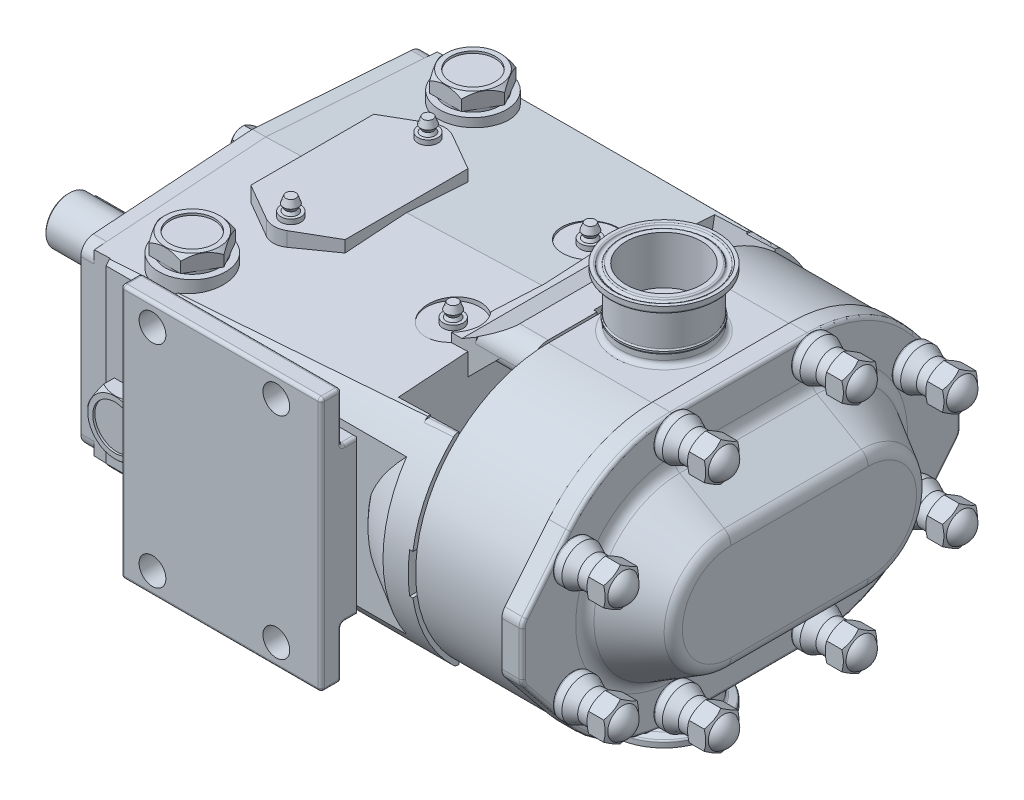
SolidWorks part; units mm, degrees
ref_plane "Front Plane" through (0, 0, 0) normal (0, 0, 1) x (1, 0, 0)
ref_plane "Top Plane" through (0, 0, 0) normal (0, 1, 0) x (1, 0, 0)
ref_plane "Right Plane" through (0, 0, 0) normal (1, 0, 0) x (0, 0, -1)
other "Join1"
other "cleanout plug<2>@018_U2_Lower Shaft"
other "grease fitting<7>@018_U2_Lower Shaft"
other "grease fitting<3>@018_U2_Lower Shaft"
other "cleanout plug<1>@018_U2_Lower Shaft"
other "grease fitting<6>@018_U2_Lower Shaft"
other "grease fitting<1>@018_U2_Lower Shaft"
other "oil plug<6>@018_U2_Lower Shaft"
other "oil plug<5>@018_U2_Lower Shaft"
other "oil plug<4>@018_U2_Lower Shaft"
other "oil plug<3>@018_U2_Lower Shaft"
other "oil plug<2>@018_U2_Lower Shaft"
other "Key<1>@018_U2_Lower Shaft"
other "Shaft<1>@018_U2_Lower Shaft"
other "oil plug<1>@018_U2_Lower Shaft"
other "108369<8>@018_U2_Lower Shaft"
other "108369<7>@018_U2_Lower Shaft"
other "108369<6>@018_U2_Lower Shaft"
other "108369<5>@018_U2_Lower Shaft"
other "108369<4>@018_U2_Lower Shaft"
other "108369<3>@018_U2_Lower Shaft"
other "108369<2>@018_U2_Lower Shaft"
other "108369<1>@018_U2_Lower Shaft"
other "101842<1>@018_U2_Lower Shaft"
other "101865<1>@018_U2_Lower Shaft"
other "020110000<1>@018_U2_Lower Shaft"
other "plate<1>@018_U2_Lower Shaft"
other "102276<1>@018_U2_Lower Shaft"
other "030360005<2>@018_U2_Lower Shaft"
other "030360005<1>@018_U2_Lower Shaft"
